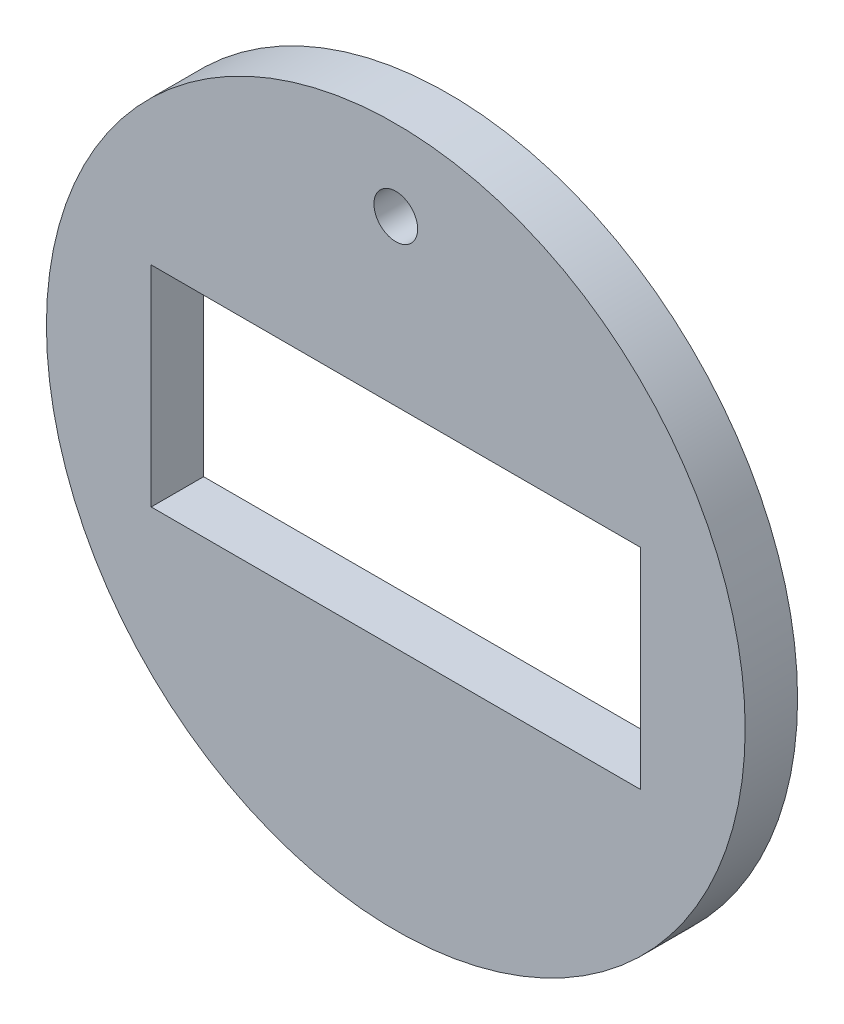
SolidWorks part; units mm, degrees
ref_plane "Front Plane" through (0, 0, 0) normal (0, 0, 1) x (1, 0, 0)
ref_plane "Top Plane" through (0, 0, 0) normal (0, 1, 0) x (1, 0, 0)
ref_plane "Right Plane" through (0, 0, 0) normal (1, 0, 0) x (0, 0, -1)
sketch "Sketch1" plane through (0, 0, 0) normal (0, 0, 1) x (1, 0, 0)
  circle A0 centre (0, 0) radius 25.4
  dimension "D1" = 50.8
extrude "Extrude1" add sketch "Sketch1" along normal blind 3.81
sketch "Sketch2" plane through (0, 0, 0) normal (0, 0, 1) x (1, 0, 0)
  circle A0 centre (0, 19.558) radius 1.5875
  dimension "D1" = 3.175
  dimension "D2" = 19.558
sketch "Sketch4" plane through (0, 0, 3.81) normal (0, 0, 1) x (1, 0, 0)
  line L1 (-17.78, 7.62) -> (17.78, 7.62)
  line L2 (-17.78, 7.62) -> (-17.78, -7.62)
  line L3 (-17.78, -7.62) -> (17.78, -7.62)
  line L4 (17.78, 7.62) -> (17.78, -7.62)
  dimension "D1" = 35.56
  dimension "D2" = 15.24
  dimension "D3" = 17.78
  dimension "D4" = 7.62
extrude "Cut-Extrude1" cut sketch "Sketch4" against normal through all
extrude "Cut-Extrude3" cut sketch "Sketch2" along normal through all
